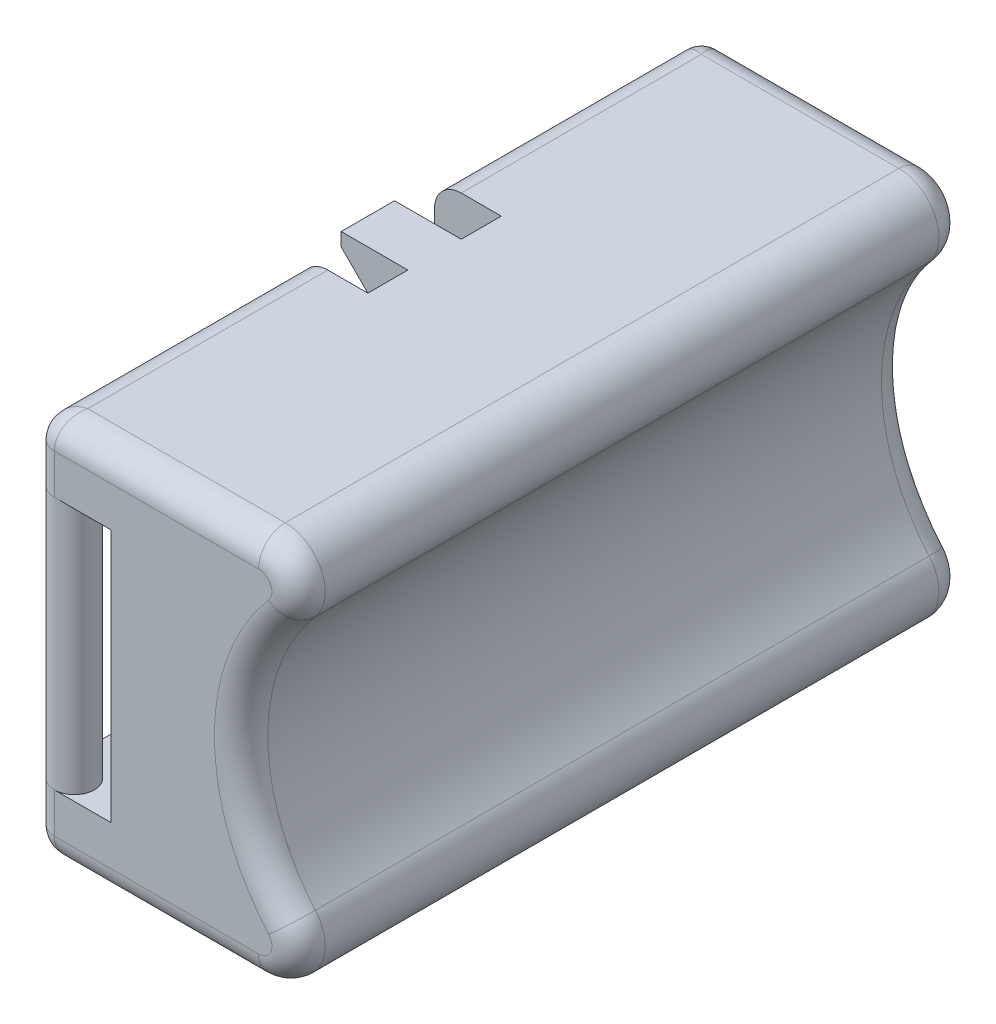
SolidWorks part; units mm, degrees
ref_plane "Front Plane" through (0, 0, 0) normal (0, 0, 1) x (1, 0, 0)
ref_plane "Top Plane" through (0, 0, 0) normal (0, 1, 0) x (1, 0, 0)
ref_plane "Right Plane" through (0, 0, 0) normal (1, 0, 0) x (0, 0, -1)
sketch "Sketch1" plane through (0, 0, 0) normal (0, 1, 0) x (1, 0, 0)
  line L0 (-15, 25) -> (15, -25) construction
  line L1 (-15, 25) -> (15, 25)
  line L2 (-15, 25) -> (-15, -25)
  line L3 (-15, -25) -> (15, -25)
  line L4 (15, 25) -> (15, -25)
  dimension "D1" = 50
  dimension "D2" = 30
extrude "Boss-Extrude1" add sketch "Sketch1" along normal mid plane 29
ref_plane "Plane1" through (0, 9.5, 0) normal (0, 1, 0) x (1, 0, 0)
sketch "Sketch2" plane through (0, 9.5, 0) normal (0, 1, 0) x (1, 0, 0)
  line L0 (-15, -25) -> (15, -25) construction
  line L1 (-15, 25) -> (-15, -25) construction
  circle A0 centre (-13.5, -23.5) radius 1.5
  circle A1 centre (-13.5, -23.5) radius 4.5
  dimension "D1" = 3
  dimension "D2" = 3
extrude "Cut-Extrude1" cut sketch "Sketch2" against normal offset from surface (19 mm away) 5
mirror "Mirror2" about plane through (0, 0, 0) normal (0, 0, 1) of "Cut-Extrude1"
fillet "Fillet2" radius 1.5 4 edges at (-15, -12, 25) (-15, 12, 25) (-15, -12, -25) (-15, 12, -25)
sketch "Sketch3" plane through (0, 0, 25) normal (0, 0, 1) x (1, 0, 0)
  line L0 (15, 14.5) -> (15, -14.5) construction
  circle A0 centre (15, 0) radius 14.5
extrude "Cut-Extrude2" cut sketch "Sketch3" against normal through all
fillet "Fillet3" radius 3 2 edges at (15, -14.5, 0) (15, 14.5, 0)
sketch "Sketch4" plane through (0, -14.5, 0) normal (0, -1, 0) x (1, 0, 0)
  line L0 (-15, -23.5) -> (-15, 23.5) construction
  line L1 (-10, 5) -> (-15, 5)
  line L2 (-10, 5) -> (-10, 2)
  line L3 (-10, -5) -> (-15, -5)
  line L4 (-15, 5) -> (-15, 2)
  line L5 (0, 0) -> (-38.8414, 0) construction
  line L6 (-15, -5) -> (-10, 5) construction
  line L7 (-10, 2) -> (-15, 2)
  line L8 (-10, -2) -> (-15, -2)
  line L9 (-10, -2) -> (-10, -5)
  line L10 (-15, -2) -> (-15, -5)
  point P9 (-12.5, 0)
  dimension "D1" = 10
  dimension "D2" = 5
  dimension "D3" = 3
  dimension "D4" = 3
sketch "Sketch5" plane through (0, 0, 0) normal (0, 0, 1) x (1, 0, 0)
  line L0 (-10, -14.5) -> (-15, -9.5)
  line L1 (-15, -14.5) -> (-15, -9.5) construction
  line L2 (-15, -14.5) -> (-10, -14.5) construction
  point P0 (-15, -14.5)
  point P2 (-10, -14.5)
sweep "Cut-Sweep1" cut profiles "Sketch4" path "Sketch5"
sketch "Sketch7" plane through (0, 0, 2) normal (0, 0, 1) x (1, 0, 0)
  line L0 (-15, -9.5) -> (-13, -11.5)
  line L1 (-15, -9.5) -> (-10, -14.5) construction
  line L3 (-15, -14.5) -> (-15, -9.5) construction
  line L4 (-15, -11.5) -> (-15, -9.5)
  line L5 (-13, -11.5) -> (-15, -13.5)
  line L6 (-15, -13.5) -> (-15, -11.5)
  dimension "D1" = 4
extrude "Cut-Extrude3" cut sketch "Sketch7" against normal up to surface (4 mm away)
mirror "Mirror3" about plane through (0, 0, 0) normal (0, 1, 0) of "Cut-Extrude3", "Cut-Sweep1"
fillet "Fillet4" radius 2 18 edges at (-15, -14.5, -14.25) (-14.5607, -14.5, -24.5607) (-5.8455, -14.5, -25) (4.5399, -12.7421, -25) (0.5, 0, -25) (4.5399, 12.7421, -25) (-15, 14.5, -14.25) (-14.5607, 14.5, -24.5607) (-15, 14.5, 14.25) (-14.5607, 14.5, 24.5607) (-5.8455, 14.5, 25) (4.5399, 12.7421, 25) (-15, -14.5, 14.25) (-14.5607, -14.5, 24.5607) (-5.8455, -14.5, 25) (4.5399, -12.7421, 25) (-5.8455, 14.5, -25) (0.5, 0, 25)
